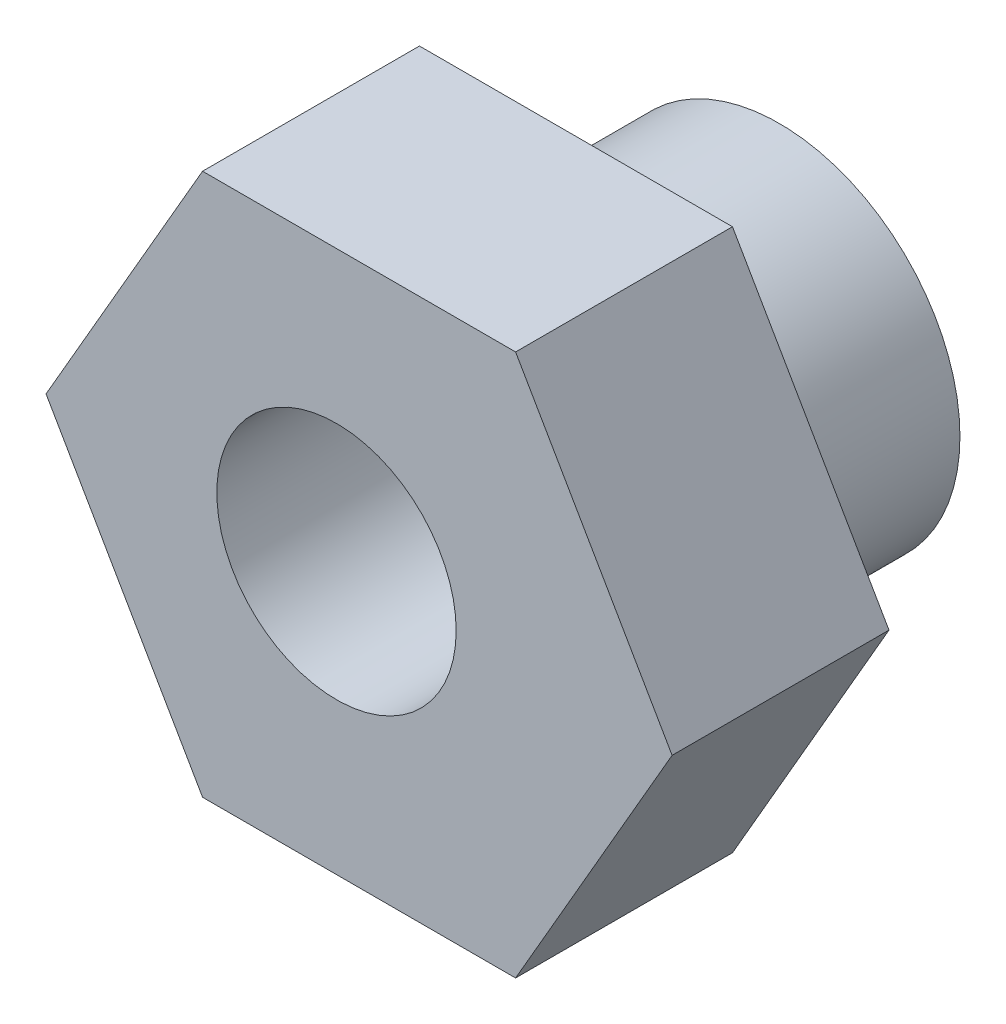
SolidWorks part; units mm, degrees
ref_plane "Alzado" through (0, 0, 0) normal (0, 0, 1) x (1, 0, 0)
ref_plane "Planta" through (0, 0, 0) normal (0, 1, 0) x (1, 0, 0)
ref_plane "Vista lateral" through (0, 0, 0) normal (1, 0, 0) x (0, 0, -1)
other "Graphic1"
other "Graphic (Closed) -1"
imported_body "Imported1"
other "Convert Mesh to Standard1"
